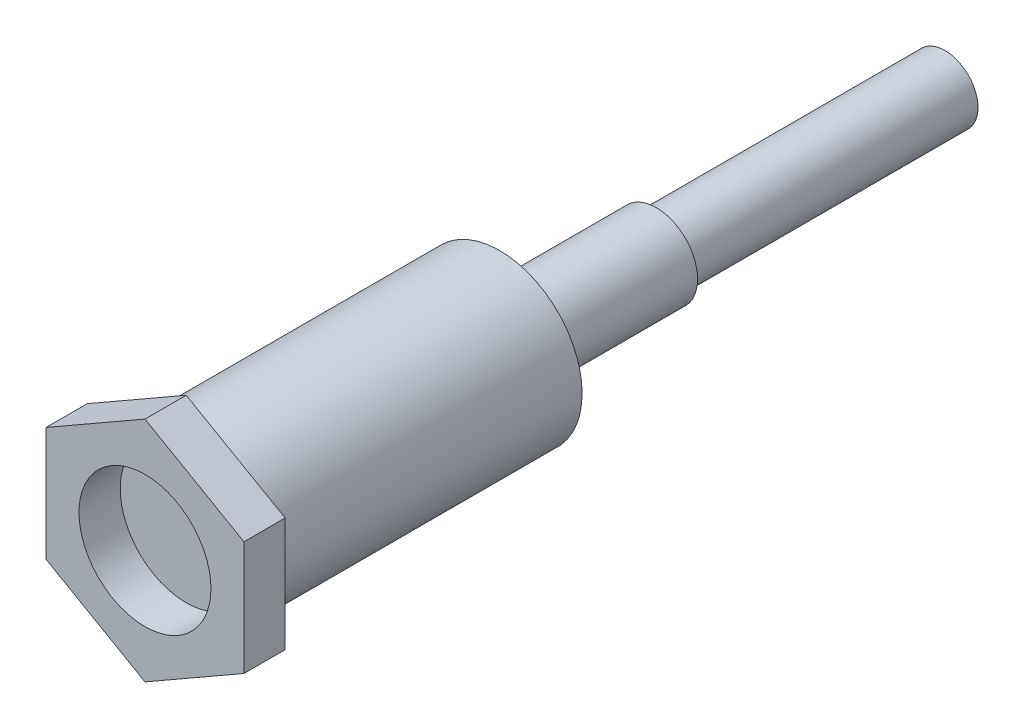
SolidWorks part; units mm, degrees
ref_plane "Plan de face" through (0, 0, 0) normal (0, 0, 1) x (1, 0, 0)
ref_plane "Plan de dessus" through (0, 0, 0) normal (0, 1, 0) x (1, 0, 0)
ref_plane "Plan de droite" through (0, 0, 0) normal (1, 0, 0) x (0, 0, -1)
sketch "Esquisse1" plane through (0, 0, 0) normal (0, 0, 1) x (1, 0, 0)
  line L0 (0, 0) -> (0, 43.8476) construction
  line L1 (0, 0) -> (39.2372, 0) construction
  line L2 (0, 13.8) -> (12, 6.9169)
  line L3 (12, 6.9169) -> (12, -6.9169)
  line L4 (0, -13.8) -> (12, -6.9169)
  line L5 (0, -13.8) -> (-12, -6.9169)
  line L6 (-12, 6.9169) -> (-12, -6.9169)
  line L7 (0, 13.8) -> (-12, 6.9169)
  circle A0 centre (0, 0) radius 8
  point P8 (12, 0)
  point P11 (-12, 0)
  dimension "D3" = 16
  dimension "D1" = 24
  dimension "D2" = 27.6
extrude "Extrusion1" add sketch "Esquisse1" along normal blind 5
sketch "Esquisse2" plane through (0, 0, 0) normal (0, 1, 0) x (1, 0, 0)
  line L0 (0, -5) -> (0, 101.6653) construction
  line L1 (0, 0) -> (-10, 0)
  line L2 (0, 0) -> (-12, 0) construction
  line L3 (-10, 0) -> (-10, 38)
  line L4 (-10, 38) -> (-4, 38)
  line L5 (-4, 38) -> (-4, 41)
  line L6 (-4, 41) -> (-5, 41)
  line L7 (-5, 41) -> (-5, 57)
  line L8 (-5, 57) -> (-4.5, 57)
  line L9 (0, 92) -> (0, 0)
  line L10 (0, -5) -> (-12, -5) construction
  line L11 (-4.5, 57) -> (-4, 57.5)
  line L12 (-4, 57.5) -> (-4, 92)
  line L13 (-4, 92) -> (0, 92)
  point P14 (-6, -5)
  dimension "D1" = 20
  dimension "D2" = 10
  dimension "D3" = 43
  dimension "D4" = 19
  dimension "D5" = 8
  dimension "D6" = 3
  dimension "D7" = 8
  dimension "D8" = 45
  dimension "D9" = 9
  dimension "D10" = 35
revolve "Révolution1" add sketch "Esquisse2" angle 360 about L0
